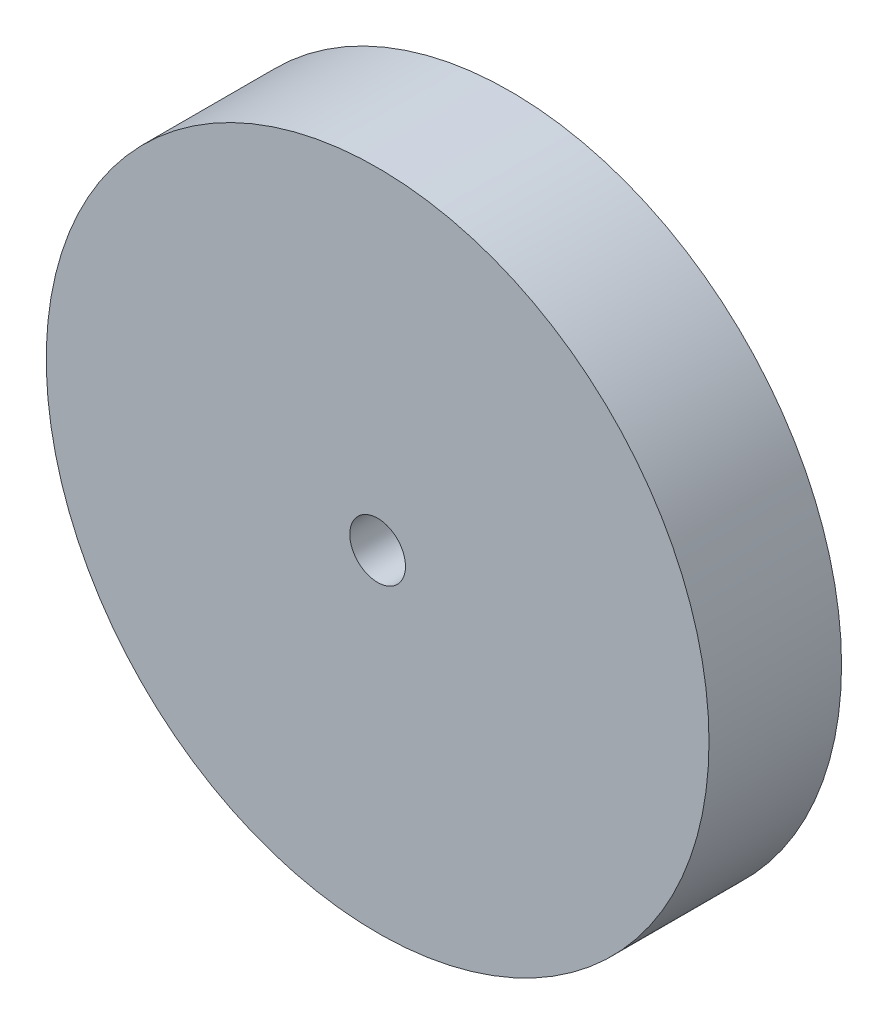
SolidWorks part; units mm, degrees
ref_plane "Plan de face" through (0, 0, 0) normal (0, 0, 1) x (1, 0, 0)
ref_plane "Plan de dessus" through (0, 0, 0) normal (0, 1, 0) x (1, 0, 0)
ref_plane "Plan de droite" through (0, 0, 0) normal (1, 0, 0) x (0, 0, -1)
sketch "Esquisse1" plane through (0, 0, 0) normal (0, 0, 1) x (1, 0, 0)
  circle A0 centre (0, 0) radius 25
  dimension "D1" = 50
extrude "Boss.-Extru.1" add sketch "Esquisse1" along normal blind 10
hole_wizard "Trou taraudé M51" positions "Esquisse3" profile "Esquisse2" tap size "M5" standard "ISO"
sketch "Esquisse3" plane through (0, 0, 10) normal (0, 0, 1) x (1, 0, 0)
  circle A0 centre (0, 0) radius 25 construction
  point P0 (0, 0)
sketch "Esquisse2" plane through (0, 0, 10) normal (1, 0, 0) x (0, -1, 0)
  line L0 (0, 0) -> (0, 10)
  line L1 (0, 10) -> (2.1, 10)
  line L2 (2.1, 10) -> (2.1, 0)
  line L5 (2.1, 0) -> (0, 0)
  line L11 (0, -6.35) -> (0, 107.95) construction
  dimension "Diamètre du trou pour taraudage jusqu'au prochain" = 4.2
  dimension "Profondeur du trou pour taraudage jusqu'au prochain" = 10
